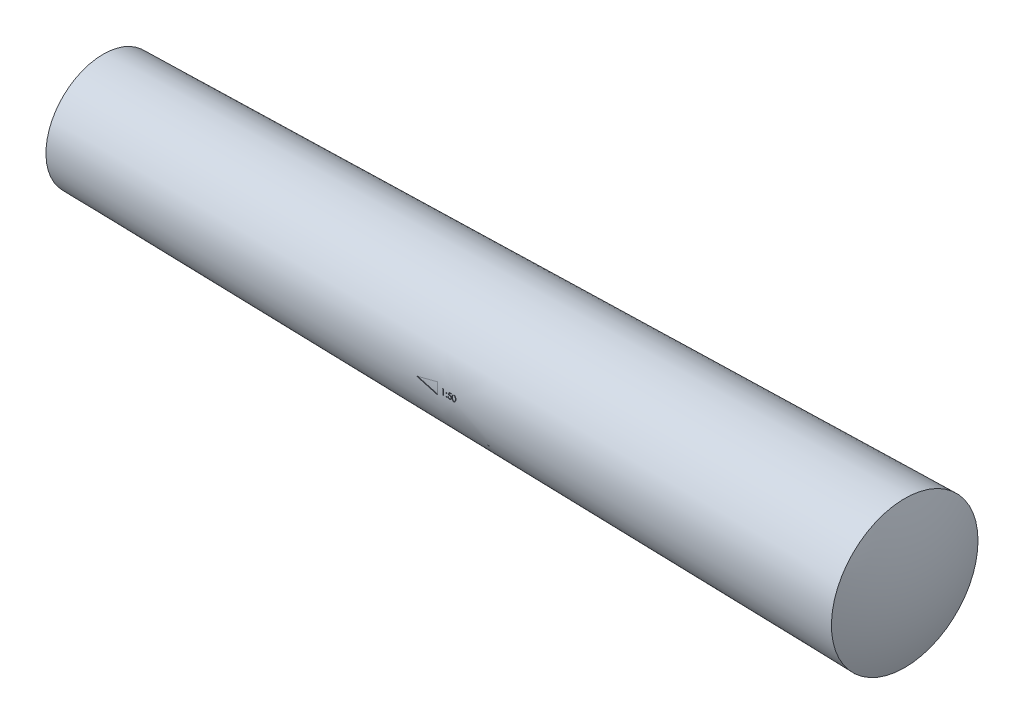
SolidWorks part; units mm, degrees
ref_plane "Front Plane" through (0, 0, 0) normal (0, 0, 1) x (1, 0, 0)
ref_plane "Top Plane" through (0, 0, 0) normal (0, 1, 0) x (1, 0, 0)
ref_plane "Right Plane" through (0, 0, 0) normal (1, 0, 0) x (0, 0, -1)
sketch "Sketch1" plane through (0, 0, 0) normal (1, 0, 0) x (0, 0, -1)
  circle A0 centre (0, 0) radius 10
  dimension "D1" = 20
extrude "Extrude1" add sketch "Sketch1" along normal mid plane 140
draft "Draft1" type of draft neutral plane draft angle 1.146 faces to draft 1 parameters "D1"=1.146
sketch "Sketch2" plane through (0, 0, 0) normal (0, 0, 1) x (1, 0, 0)
  line L0 (-70, 0) -> (-70, 10)
  line L1 (-70, 10) -> (-70, -10) construction
  line L2 (-70, 0) -> (-72.5, 0)
  line L3 (-72.5, 0) -> (-72.5, -11.4) construction
  line L4 (70, 0) -> (70, 12.8001)
  line L5 (70, -12.8001) -> (70, 12.8001) construction
  line L6 (70, 0) -> (72.5, 0)
  line L7 (72.5, 0) -> (72.5, -11.4) construction
  line L8 (-70, -10) -> (70, -12.8001) construction
  arc A0 (-72.5, 0) -> (-70, 10) centre (-51.25, 0) cw
  arc A1 (72.5, 0) -> (70, 12.8001) centre (38.4815, 0) ccw
  point P14 (0, -11.4)
revolve "Revolve1" add sketch "Sketch2" angle 360 about L2
sketch "Sketch5" plane through (0, 0, 0) normal (0, 0, 1) x (1, 0, 0)
  line L0 (0, 11.4) -> (0, -11.4) construction
  line L1 (70, 12.8001) -> (-70, 10) construction
  line L2 (-70, -10) -> (70, -12.8001) construction
ref_plane "Plane2" through (0, 0, 0) normal (-0.02, 0, 0.9998) x (0.9998, 0, 0.02)
sketch "Sketch6" plane through (0, 0, 0) normal (-0.02, 0, 0.9998) x (0.9998, 0, 0.02)
  line L0 (0, 0) -> (0, 1)
  line L1 (0, 11.4) -> (0, -11.4) construction
  line L2 (0, 1) -> (-3.7321, 0)
  line L3 (-3.7321, 0) -> (0, -1)
  line L4 (0, -1) -> (0, 0)
  line L5 (0, -0.5) -> (4, -0.5) construction
  text T0 "1:50" font "Century Gothic" height 1
  dimension "D1" = 2
  dimension "D2" = 30
  dimension "D3" = 4
wrap "Wrap2" sketch "Sketch6" wrap type deboss source sketch "Sketch6" thickness 0.1 parameters "D1"=0.1
equation "\"D2@Sketch2\" = \"D1@Sketch2\""
